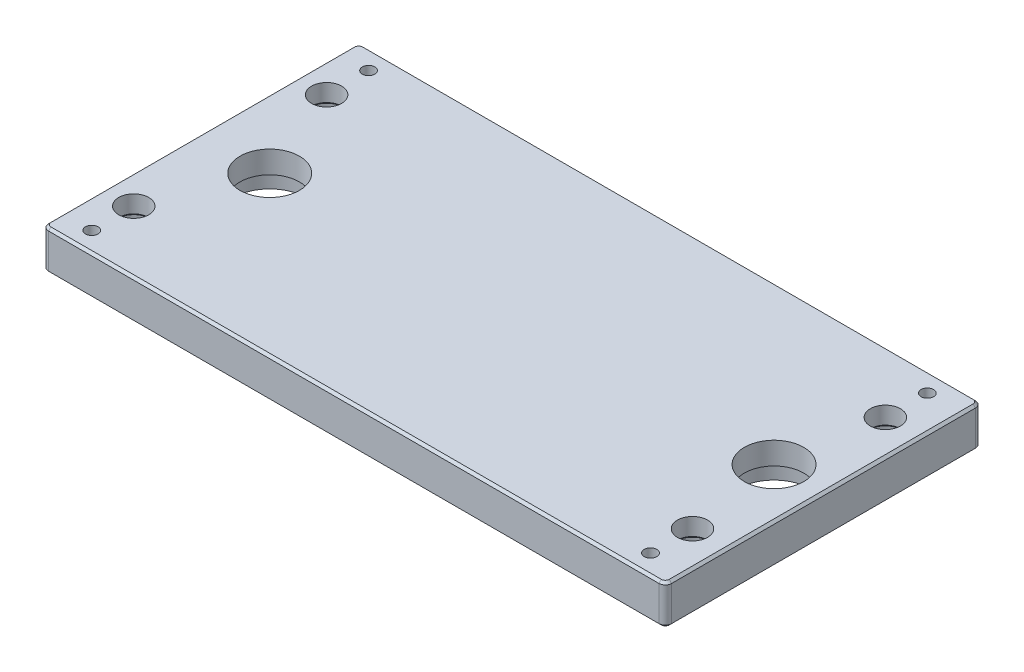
SolidWorks part; units mm, degrees
ref_plane "Front Plane" through (0, 0, 0) normal (0, 0, 1) x (1, 0, 0)
ref_plane "Top Plane" through (0, 0, 0) normal (0, 1, 0) x (1, 0, 0)
ref_plane "Right Plane" through (0, 0, 0) normal (1, 0, 0) x (0, 0, -1)
sketch "Sketch1" plane through (0, 0, 0) normal (0, 1, 0) x (1, 0, 0)
  line L1 (-98.425, 50.8) -> (101.6, 50.8)
  line L2 (-98.425, 50.8) -> (-98.425, -50.8)
  line L3 (-98.425, -50.8) -> (101.6, -50.8)
  line L4 (101.6, 50.8) -> (101.6, -50.8)
  dimension "D1" = 101.6
  dimension "D2" = 200.025
  dimension "D3" = 50.8
  dimension "D4" = 98.425
extrude "Boss-Extrude1" add sketch "Sketch1" along normal blind 12.7
hole_wizard "#10-32 Tapped Hole1" positions "Sketch3" profile "Sketch2" tap size "#10-32" standard "ANSI Inch"
sketch "Sketch3" plane through (0, 0, 0) normal (0, -1, 0) x (-1, 0, 0)
  point P0 (88.9, -44.45)
  point P2 (-90.5002, -44.45)
  point P4 (-90.5002, 44.45)
  point P6 (88.9, 44.45)
  dimension "D1" = 90.5002
  dimension "D2" = 88.9
  dimension "D3" = 44.45
  dimension "D4" = 88.9
sketch "Sketch2" plane through (-88.9, 0, 44.45) normal (1, 0, 0) x (0, 0, -1)
  line L0 (0, 0) -> (0, 12.7)
  line L1 (0, 12.7) -> (2.0193, 12.7)
  line L2 (2.0193, 12.7) -> (2.0193, 0)
  line L5 (2.0193, 0) -> (0, 0)
  line L11 (0, -6.35) -> (0, 107.95) construction
  dimension "Thru Tap Drill Dia." = 4.0386
  dimension "Thru Tap Drill Depth" = 12.7
hole_wizard "CBORE for 1/4 Socket Head Cap Screw1" positions "Sketch5" profile "Sketch4" counterbore size "1/4" standard "ANSI Inch"
sketch "Sketch5" plane through (0, 0, 0) normal (0, -1, 0) x (-1, 0, 0)
  point P0 (76.2, 0)
  point P2 (-85.725, 0)
  dimension "D1" = 76.2
  dimension "D2" = 85.725
sketch "Sketch4" plane through (-76.2, 0, 0) normal (1, 0, 0) x (0, 0, -1)
  line L0 (0, 0) -> (0, 17.4244)
  line L1 (0, 17.4244) -> (9.5377, 17.4244)
  line L2 (9.5377, 17.4244) -> (9.5377, 5.5372)
  line L3 (9.5377, 5.5372) -> (11.811, 5.5372)
  line L4 (11.811, 5.5372) -> (11.811, 0)
  line L5 (11.811, 0) -> (0, 0)
  line L10 (0, 17.4244) -> (-9.5377, 17.4244) construction
  line L11 (0, -6.35) -> (0, 107.95) construction
  dimension "Hole Dia." = 19.0754
  dimension "Hole Depth" = 17.4244
  dimension "C'Bore Dia." = 23.622
  dimension "C'Bore Depth" = 5.5372
  dimension "Drill Angle" = 180
hole_wizard "CBORE for 1/4 Socket Head Cap Screw2" positions "Sketch9" profile "Sketch8" counterbore size "1/4" standard "ANSI Inch"
sketch "Sketch9" plane through (0, 0, 0) normal (0, -1, 0) x (-1, 0, 0)
  line L0 (0, -89.0094) -> (0, 72.0409) construction
  point P0 (88.9, -30.9626)
  point P2 (-90.5002, -30.9626)
  point P4 (-90.5002, 30.9626)
  point P6 (88.9, 30.9626)
  dimension "D1" = 88.9
  dimension "D2" = 90.5002
  dimension "D3" = 30.9626
  dimension "D4" = 30.9626
sketch "Sketch8" plane through (-88.9, 0, 30.9626) normal (1, 0, 0) x (0, 0, -1)
  line L0 (0, 0) -> (0, 17.4244)
  line L1 (0, 17.4244) -> (4.826, 17.4244)
  line L2 (4.826, 17.4244) -> (4.826, 6.3754)
  line L3 (4.826, 6.3754) -> (8.128, 6.3754)
  line L4 (8.128, 6.3754) -> (8.128, 0)
  line L5 (8.128, 0) -> (0, 0)
  line L10 (0, 17.4244) -> (-4.826, 17.4244) construction
  line L11 (0, -6.35) -> (0, 107.95) construction
  dimension "Hole Dia." = 9.652
  dimension "Hole Depth" = 17.4244
  dimension "C'Bore Dia." = 16.256
  dimension "C'Bore Depth" = 6.3754
  dimension "Drill Angle" = 180
fillet "Fillet1" radius 2.032 4 edges at (-98.425, 6.35, 50.8) (-98.425, 6.35, -50.8) (101.6, 6.35, -50.8) (101.6, 6.35, 50.8)
chamfer "Chamfer1" distance 0.762 angle 45 16 edges at (-98.425, 0, 0) (1.5875, 0, -50.8) (101.6, 0, 0) (1.5875, 0, 50.8) (-98.425, 12.7, 0) (1.5875, 12.7, -50.8) (101.6, 12.7, 0) (1.5875, 12.7, 50.8) (-97.8298, 0, -50.2048) (101.0048, 0, -50.2048) (-97.8298, 0, 50.2048) (101.0048, 0, 50.2048) (-97.8298, 12.7, -50.2048) (101.0048, 12.7, -50.2048) (-97.8298, 12.7, 50.2048) (101.0048, 12.7, 50.2048)
chamfer "Chamfer2" distance 0.762 angle 45 8 edges at (90.5002, 0, -46.4693) (-88.9, 0, -46.4693) (-88.9, 0, 42.4307) (90.5002, 0, 42.4307) (-88.9, 6.3754, -35.7886) (-88.9, 6.3754, 26.1366) (90.5002, 6.3754, -35.7886) (90.5002, 6.3754, 26.1366)
sketch "Sketch10" plane through (0, 0, -50.8) normal (0, 0, -1) x (-1, 0, 0)
  text T0 "0" font "Century Gothic" height in points 18
extrude "Cut-Extrude1" cut sketch "Sketch10" against normal blind 0.0508
